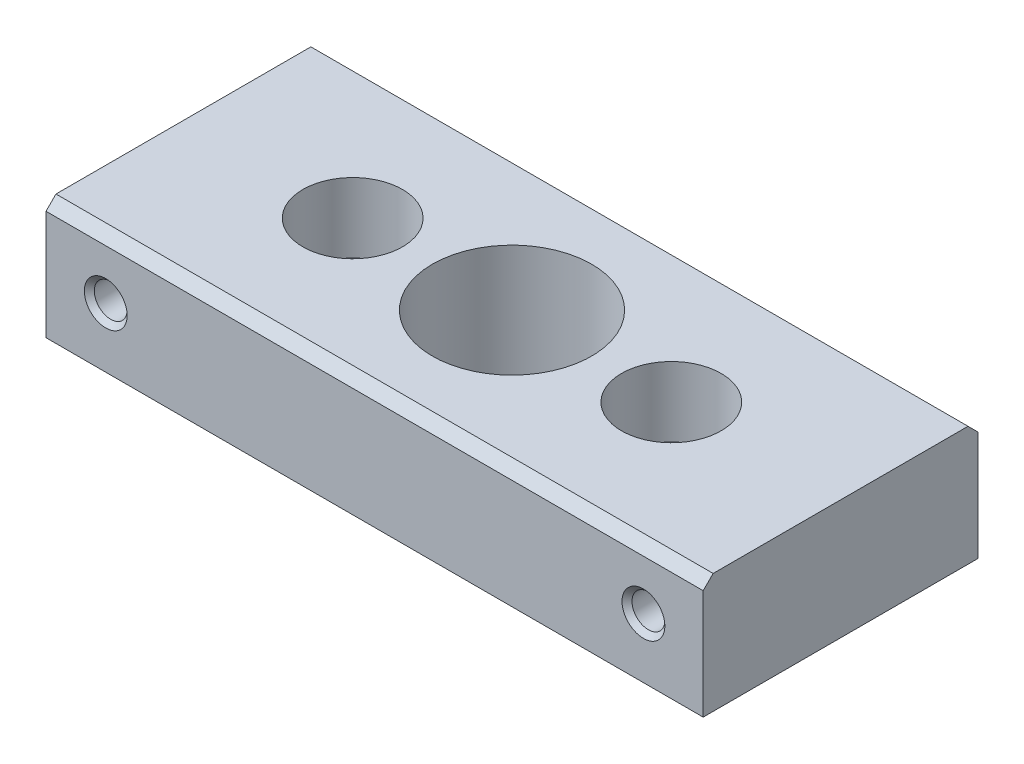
SolidWorks part; units mm, degrees
ref_plane "Спереди" through (0, 0, 0) normal (0, 0, 1) x (1, 0, 0)
ref_plane "Сверху" through (0, 0, 0) normal (0, 1, 0) x (1, 0, 0)
ref_plane "Справа" through (0, 0, 0) normal (1, 0, 0) x (0, 0, -1)
sketch "Эскиз1" plane through (0, 0, 0) normal (0, 0, 1) x (1, 0, 0)
  line L1 (-33, 0) -> (33, 0)
  line L2 (-33, 0) -> (-33, 12)
  line L3 (-33, 12) -> (33, 12)
  line L4 (33, 0) -> (33, 12)
  point P4 (0, 0)
  dimension "D1" = 12
  dimension "D2" = 66
extrude "Бобышка-Вытянуть1" add sketch "Эскиз1" against normal blind 27.6
sketch "Эскиз2" plane through (0, 12, 0) normal (0, 1, 0) x (1, 0, 0)
  line L0 (33, 27.6) -> (33, 0) construction
  line L1 (0, 0) -> (0, 30.6904) construction
  circle A0 centre (0, 13.8) radius 8
  circle A1 centre (-16, 13.8) radius 3
  circle A2 centre (16, 13.8) radius 3
  point P4 (33, 13.8)
  dimension "D1" = 16
  dimension "D2" = 6
  dimension "D3" = 32
extrude "Вырез-Вытянуть1" cut sketch "Эскиз2" against normal through all
sketch "Эскиз3" plane through (0, 12, 0) normal (0, 1, 0) x (1, 0, 0)
  circle A0 centre (-16, 13.8) radius 5
  circle A1 centre (16, 13.8) radius 5
  dimension "D1" = 10
extrude "Вырез-Вытянуть2" cut sketch "Эскиз3" against normal blind 7
hole_wizard "Отверстие обработанное метчиком M41" positions "Эскиз5" profile "Эскиз4" tap size "M4" standard "DIN"
sketch "Эскиз5" plane through (0, 0, 0) normal (0, 0, 1) x (1, 0, 0)
  line L0 (33, 0) -> (33, 12) construction
  line L1 (0, 0) -> (0, 16.4031) construction
  point P0 (-27, 6)
  point P2 (27, 6)
  point P6 (33, 6)
  dimension "D1" = 54
sketch "Эскиз4" plane through (-27, 6, 0) normal (1, 0, 0) x (0, -1, 0)
  line L0 (0, 0) -> (0, 15.9914)
  line L1 (0, 15.9914) -> (1.65, 15)
  line L2 (1.65, 15) -> (1.65, 0)
  line L5 (1.65, 0) -> (0, 0)
  line L10 (0, 15.9914) -> (-1.65, 15) construction
  line L11 (0, -6.35) -> (0, 107.95) construction
  dimension "Диаметр сверла" = 3.3
  dimension "Глубина сверла" = 15
  dimension "Угол заточки сверла" = 118
hole_wizard "Отверстие обработанное метчиком M42" positions "Эскиз7" profile "Эскиз6" tap size "M4" standard "DIN"
sketch "Эскиз7" plane through (0, 0, -27.6) normal (0, 0, -1) x (-1, 0, 0)
  line L0 (33, 12) -> (33, 0) construction
  line L1 (0, 0) -> (0, 15.8328) construction
  point P0 (27, 6)
  point P2 (-27, 6)
  point P7 (33, 6)
  dimension "D1" = 54
sketch "Эскиз6" plane through (-27, 6, -27.6) normal (1, 0, 0) x (0, 1, 0)
  line L0 (0, 0) -> (0, 15.9914)
  line L1 (0, 15.9914) -> (1.65, 15)
  line L2 (1.65, 15) -> (1.65, 0)
  line L5 (1.65, 0) -> (0, 0)
  line L10 (0, 15.9914) -> (-1.65, 15) construction
  line L11 (0, -6.35) -> (0, 107.95) construction
  dimension "Диаметр сверла" = 3.3
  dimension "Глубина сверла" = 15
  dimension "Угол заточки сверла" = 118
chamfer "Фаска1" distance 0.5 angle 45 4 edges at (28.65, 6, 0) (-25.35, 6, 0) (-28.65, 6, -27.6) (25.35, 6, -27.6)
chamfer "Фаска2" distance 1 angle 45 2 edges at (0, 12, -27.6) (0, 12, 0)
